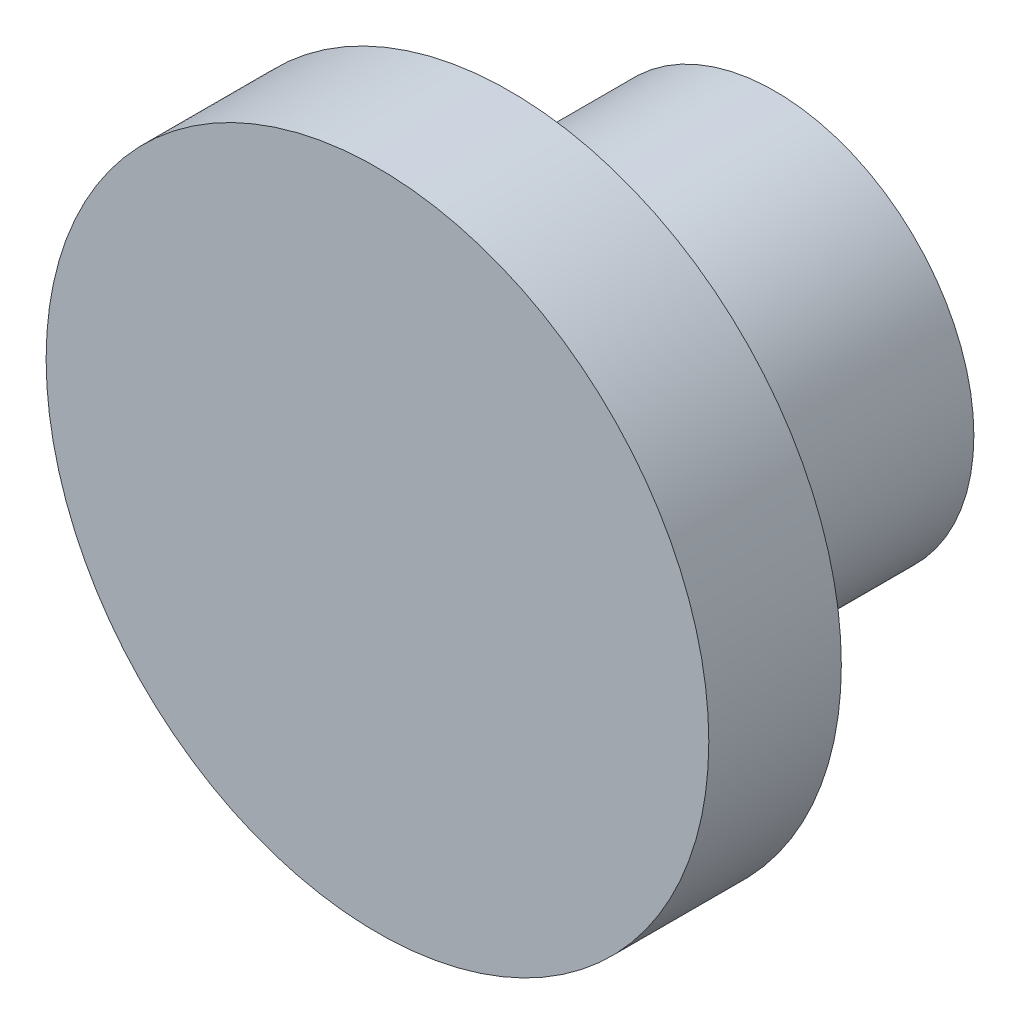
SolidWorks part; units mm, degrees
ref_plane "Face" through (0, 0, 0) normal (0, 0, 1) x (1, 0, 0)
ref_plane "Dessus" through (0, 0, 0) normal (0, 1, 0) x (1, 0, 0)
ref_plane "Droite" through (0, 0, 0) normal (1, 0, 0) x (0, 0, -1)
sketch "Esquisse1" plane through (0, 0, 0) normal (0, 0, 1) x (1, 0, 0)
  circle A0 centre (35, 60) radius 15 construction
  circle A1 centre (35, 60) radius 8 construction
  circle A2 centre (35, 60) radius 15
  circle A3 centre (35, 60) radius 8
extrude "Base-Extrusion" add sketch "Esquisse1" against normal blind 20
sketch "Esquisse2" plane through (0, 0, 0) normal (0, 0, 1) x (1, 0, 0)
  circle A0 centre (35, 60) radius 25
  circle A1 centre (35, 60) radius 15 construction
  dimension "D1" = 50
extrude "Boss.-Extru.1" add sketch "Esquisse2" along normal blind 10
